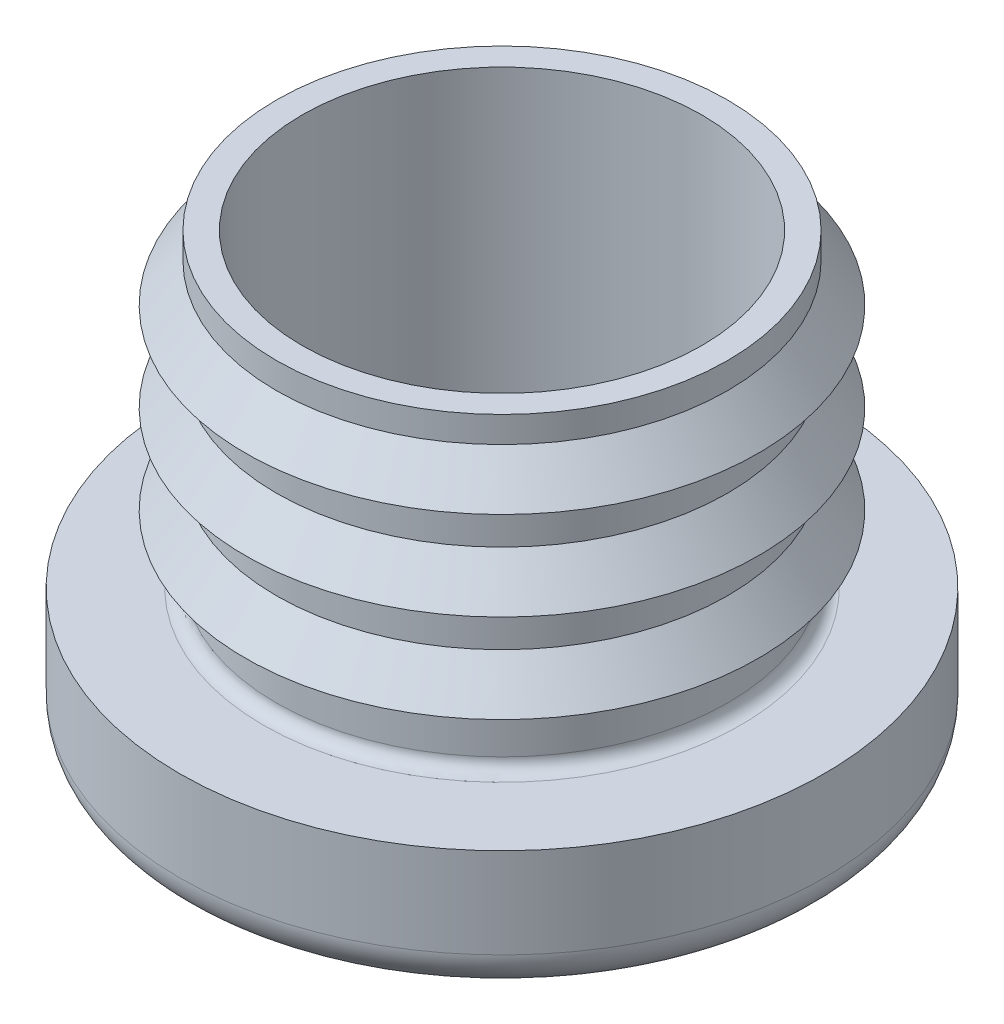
SolidWorks part; units mm, degrees
ref_plane "Plan de face" through (0, 0, 0) normal (0, 0, 1) x (1, 0, 0)
ref_plane "Plan de dessus" through (0, 0, 0) normal (0, 1, 0) x (1, 0, 0)
ref_plane "Plan de droite" through (0, 0, 0) normal (1, 0, 0) x (0, 0, -1)
sketch "Esquisse1" plane through (0, 0, 0) normal (0, 0, 1) x (1, 0, 0)
  line L0 (-11, 0) -> (0, 0)
  line L1 (0, 0) -> (0, 3)
  line L2 (0, 3) -> (-7.25, 3)
  line L3 (-7.75, 3.5) -> (-7.75, 17)
  line L4 (-7.75, 17) -> (-8.75, 17)
  line L5 (-8.75, 17) -> (-8.75, 15.9876)
  line L6 (-8.75, 15.9876) -> (-9.9497, 14.4876)
  line L7 (-9.9497, 14.4876) -> (-8.75, 14.4876)
  line L8 (-8.75, 14.4876) -> (-8.75, 12.5438)
  line L9 (-8.75, 12.5438) -> (-9.9497, 11.0438)
  line L10 (-9.9497, 11.0438) -> (-8.75, 11.0438)
  line L11 (-8.75, 11.0438) -> (-8.75, 9.1)
  line L12 (-8.75, 9.1) -> (-9.9497, 7.6)
  line L13 (-9.9497, 7.6) -> (-8.75, 7.6)
  line L14 (-8.75, 7.6) -> (-8.75, 5.5)
  line L15 (-9.25, 5) -> (-12.5, 5)
  line L16 (-12.5, 5) -> (-12.5, 1.5)
  line L17 (0, 0) -> (0, 17) construction
  arc A0 (-7.25, 3) -> (-7.75, 3.5) centre (-7.25, 3.5) cw
  arc A1 (-8.75, 5.5) -> (-9.25, 5) centre (-9.25, 5.5) cw
  arc A2 (-12.5, 1.5) -> (-11, 0) centre (-11, 1.5) ccw
  dimension "D5" = 1.5
  dimension "D15" = 0.5
  dimension "D16" = 0.5
  dimension "D1" = 12.5
  dimension "D2" = 8.75
  dimension "D3" = 3
  dimension "D4" = 5
  dimension "D6" = 7.75
  dimension "D7" = 1.0124
  dimension "D8" = 3.4438
  dimension "D9" = 1.9438
  dimension "D10" = 1.9438
  dimension "D11" = 2.6
  dimension "D12" = 1.5
  dimension "D13" = 1.5
  dimension "D14" = 9.9497
revolve "Révolution1" add sketch "Esquisse1" angle 360 about L17
